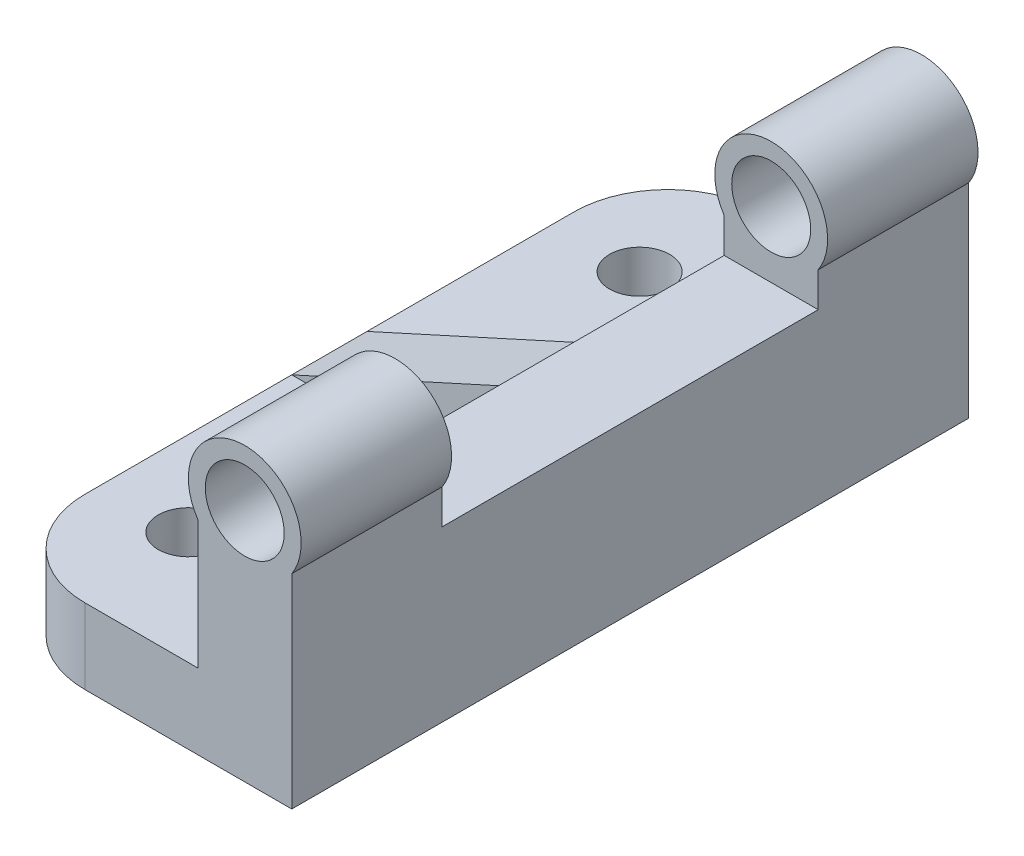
SolidWorks part; units mm, degrees
ref_plane "Front Plane" through (0, 0, 0) normal (0, 0, 1) x (1, 0, 0)
ref_plane "Top Plane" through (0, 0, 0) normal (0, 1, 0) x (1, 0, 0)
ref_plane "Right Plane" through (0, 0, 0) normal (1, 0, 0) x (0, 0, -1)
sketch "Sketch2" plane through (0, 0, 0) normal (0, 1, 0) x (1, 0, 0)
  line L0 (0, 0) -> (0, 18)
  line L1 (0, 18) -> (5, 18)
  line L2 (5, 18) -> (5, -18)
  line L3 (5, -18) -> (0, -18)
  line L4 (0, -18) -> (0, 0)
extrude "Boss-Extrude1" add sketch "Sketch2" along normal blind 12.5
sketch "Sketch3" plane through (0, 0, 0) normal (0, -1, 0) x (1, 0, 0)
  line L0 (5, 18) -> (5, -18)
  line L1 (5, -18) -> (-11, -18)
  line L2 (-11, -18) -> (-11, 18)
  line L3 (-11, 18) -> (5, 18)
extrude "Boss-Extrude2" add sketch "Sketch3" against normal blind 4
sketch "Sketch4" plane through (0, 4, 0) normal (0, 1, 0) x (1, 0, 0)
  circle A1 centre (-6.5, -12) radius 1.6
  circle A2 centre (-6.5, 12) radius 1.6
extrude "Cut-Extrude1" cut sketch "Sketch4" against normal blind 9
sketch "Sketch7" plane through (0, 0, 18) normal (0, 0, 1) x (1, 0, 0)
  line L0 (0, 12.5) -> (5, 12.5) construction
  circle A0 centre (2.5, 12.5) radius 3
extrude "Boss-Extrude3" add sketch "Sketch7" against normal up to vertex (36 mm away)
sketch "Sketch8" plane through (0, 0, 18) normal (0, 0, 1) x (1, 0, 0)
  circle A0 centre (2.5, 12.5) radius 2.1
extrude "Cut-Extrude2" cut sketch "Sketch8" against normal blind 39
ref_plane "Plane1" through (0, 17, 0) normal (0, 1, 0) x (1, 0, 0)
sketch "Sketch9" plane through (0, 17, 0) normal (0, 1, 0) x (1, 0, 0)
  line L0 (7.3526, 0) -> (7.3526, 10)
  line L1 (7.3526, 10) -> (-2.1315, 10)
  line L2 (-2.1315, 10) -> (-2.1315, -10)
  line L3 (-2.1315, -10) -> (7.3526, -10)
  line L4 (7.3526, -10) -> (7.3526, 0)
extrude "Cut-Extrude3" cut sketch "Sketch9" against normal blind 8
sketch "Sketch10" plane through (0, 0, 0) normal (0, 0, 1) x (1, 0, 0)
  line L0 (-11, 4) -> (0, 4)
  line L1 (0, 4) -> (-11, 4) construction
  line L2 (0, 4) -> (0, 9)
  line L3 (0, 9) -> (-11, 4)
extrude "Boss-Extrude4" add sketch "Sketch10" along normal blind 2 and the other way blind 2
fillet "Fillet1" radius 5 1 edges at (-11, 2, 18)
fillet "Fillet2" radius 5 1 edges at (-11, 2, -18)
